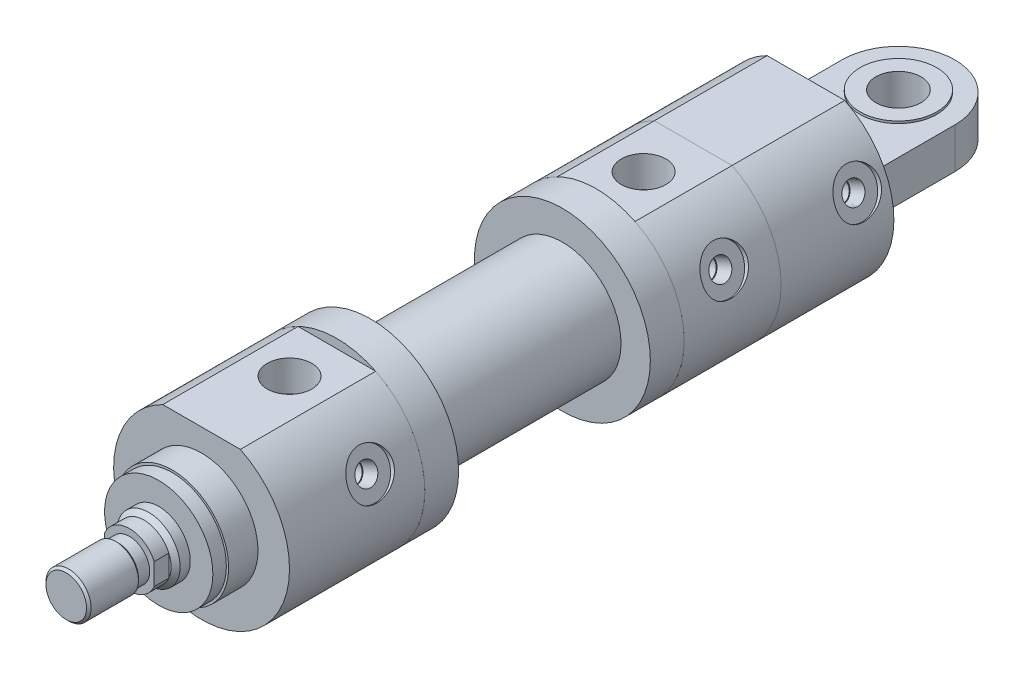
SolidWorks part; units mm, degrees
ref_plane "Plan de face" through (0, 0, 0) normal (0, 0, 1) x (1, 0, 0)
ref_plane "Plan de dessus" through (0, 0, 0) normal (0, 1, 0) x (1, 0, 0)
ref_plane "Plan de droite" through (0, 0, 0) normal (1, 0, 0) x (0, 0, -1)
sketch "Esquisse1" plane through (0, 0, 0) normal (0, 0, 1) x (1, 0, 0)
  circle A0 centre (0, 0) radius 39
  dimension "D1" = 78
extrude "Extrusion1" add sketch "Esquisse1" along normal blind 43
sketch "Esquisse2" plane through (0, 0, 43) normal (0, 0, 1) x (1, 0, 0)
  circle A0 centre (0, 0) radius 39
extrude "Extrusion2" add sketch "Esquisse2" along normal blind 15 separate body
sketch "Esquisse3" plane through (0, 0, 0) normal (0, 1, 0) x (1, 0, 0)
  line L1 (-39, -43) -> (39, -43)
  line L2 (-39, -43) -> (-39, 0)
  line L3 (-39, 0) -> (39, 0)
  line L4 (39, -43) -> (39, 0)
extrude "Enlèv. mat.-Extru.1" cut sketch "Esquisse3" along normal through all from offset 35
hole_wizard "Trou taraudé 1/2 NPT1" positions "1" profile "2" size "1/2" standard "Ansi Pouces"
sketch "1" plane through (0, 35, 0) normal (0, 1, 0) x (-1, 0, 0)
  line L1 (17.2047, 0) -> (-17.2047, 0) construction
  point P0 (0, 22)
  point P4 (0, 0)
  dimension "D1" = 22
sketch "2" plane through (0, 35, 22) normal (1, 0, 0) x (0, 0, 1)
  line L0 (0, 0) -> (0, 28.0035)
  line L1 (8.9281, 22.639) -> (0, 28.0035)
  line L2 (-8.9281, 22.639) -> (0, 28.0035) construction
  line L3 (8.9281, 22.639) -> (8.9281, 13.5712)
  line L4 (8.9281, 13.5712) -> (9.4797, 13.5712)
  line L5 (9.4797, 13.5712) -> (9.8861, 0)
  line L6 (-9.4797, 13.5712) -> (-9.8861, 0) construction
  line L7 (9.8861, 0) -> (0, 0)
  line L8 (0, -6.35) -> (0, 107.95) construction
  line L11 (-8.9281, 13.5712) -> (-9.4797, 13.5712) construction
  dimension "Diamètre du trou pour taraudage" = 17.8562
  dimension "Profondeur du trou pour taraudage" = 22.639
  dimension "Diamètre du filetage" = 19.7721
  dimension "Angle de filetage" = 3.43
  dimension "Profondeur du filetage" = 13.5712
  dimension "Angle de pointe" = 118
sketch "Esquisse6" plane through (0, 0, 58) normal (0, 0, 1) x (1, 0, 0)
  circle A0 centre (0, 0) radius 26
  dimension "D1" = 52
extrude "Extrusion3" add sketch "Esquisse6" along normal blind 85
sketch "Esquisse7" plane through (0, 0, 143) normal (0, 0, 1) x (1, 0, 0)
  circle A0 centre (0, 0) radius 39
  dimension "D1" = 78
extrude "Extrusion4" add sketch "Esquisse7" along normal blind 15
sketch "Esquisse8" plane through (0, 0, 158) normal (0, 0, 1) x (1, 0, 0)
  circle A2 centre (0, 0) radius 39
extrude "Extrusion5" add sketch "Esquisse8" along normal blind 60 separate body
sketch "Esquisse9" plane through (0, 0, 0) normal (0, 1, 0) x (1, 0, 0)
  line L0 (39, -218) -> (39, -158) construction
  line L1 (-39, -218) -> (39, -218)
  line L2 (-39, -218) -> (-39, -96)
  line L3 (-39, -96) -> (39, -96)
  line L4 (39, -218) -> (39, -96)
extrude "Enlèv. mat.-Extru.2" cut sketch "Esquisse9" along normal blind 57 from offset 35
hole_wizard "Trou taraudé 1/2 NPT2" positions "1" profile "2" size "1/2" standard "Ansi Pouces"
sketch "1" plane through (-3.0919, 35, 118.219) normal (0, 1, 0) x (-1, 0, 0)
  line L0 (14.1128, 99.781) -> (-20.2965, 99.781) construction
  point P0 (-3.0919, 60.781)
  dimension "D1" = 39
sketch "2" plane through (0, 35, 179) normal (1, 0, 0) x (0, 0, 1)
  line L0 (0, 0) -> (0, 28.0035)
  line L1 (8.9281, 22.639) -> (0, 28.0035)
  line L2 (-8.9281, 22.639) -> (0, 28.0035) construction
  line L3 (8.9281, 22.639) -> (8.9281, 13.5712)
  line L4 (8.9281, 13.5712) -> (9.4797, 13.5712)
  line L5 (9.4797, 13.5712) -> (9.8861, 0)
  line L6 (-9.4797, 13.5712) -> (-9.8861, 0) construction
  line L7 (9.8861, 0) -> (0, 0)
  line L8 (0, -6.35) -> (0, 107.95) construction
  line L11 (-8.9281, 13.5712) -> (-9.4797, 13.5712) construction
  dimension "Diamètre du trou pour taraudage" = 17.8562
  dimension "Profondeur du trou pour taraudage" = 22.639
  dimension "Diamètre du filetage" = 19.7721
  dimension "Angle de filetage" = 3.43
  dimension "Profondeur du filetage" = 13.5712
  dimension "Angle de pointe" = 118
sketch "Esquisse10" plane through (0, 0, 218) normal (0, 0, 1) x (1, 0, 0)
  circle A0 centre (0, 0) radius 25
  dimension "D1" = 50
extrude "Extrusion6" add sketch "Esquisse10" along normal blind 13
sketch "Esquisse11" plane through (0, 0, 231) normal (0, 0, 1) x (1, 0, 0)
  circle A2 centre (0, 0) radius 24
  circle A3 centre (0, 0) radius 24
  dimension "D1" = 1
extrude "Extrusion7" add sketch "Esquisse11" along normal blind 6
sketch "Esquisse12" plane through (0, 0, 237) normal (0, 0, 1) x (1, 0, 0)
  circle A0 centre (0, 0) radius 14
  dimension "D1" = 28
extrude "Extrusion8" add sketch "Esquisse12" along normal blind 6.5
chamfer "Chanfrein1" distance 2 angle 45 1 edges at (14, 0, 243.5)
sketch "Esquisse13" plane through (0, 0, 243.5) normal (0, 0, 1) x (1, 0, 0)
  circle A2 centre (0, 0) radius 12
  circle A3 centre (0, 0) radius 12
  dimension "D1" = 0
extrude "Extrusion9" add sketch "Esquisse13" along normal blind 6.5
sketch "Esquisse15" plane through (0, 0, 0) normal (1, 0, 0) x (0, 0, -1)
  line L0 (-208.2459, 0) -> (-121.0201, 0) construction
  line L1 (-250, 9) -> (-255, 9)
  line L2 (-250, 12) -> (-250, -12) construction
  line L3 (-255, 9) -> (-256, 10)
  line L4 (-256, 10) -> (-277, 10)
  line L5 (-277, 10) -> (-278, 9)
  line L6 (-278, 9) -> (-278, 0)
  line L7 (-278, 0) -> (-250, 0)
  line L8 (-250, 0) -> (-250, 9)
  dimension "D1" = 20
  dimension "D2" = 5
  dimension "D3" = 28
  dimension "D4" = 45
  dimension "D5" = 45
  dimension "D6" = 1
revolve "Révolution1" add sketch "Esquisse15" angle 360 about L0
sketch "Esquisse16" plane through (0, 0, 250) normal (0, 0, 1) x (1, 0, 0)
  line L0 (0, 0) -> (0, 19.2529) construction
  line L1 (18.6103, -23.1149) -> (11, -23.1149)
  line L2 (18.6103, -23.1149) -> (18.6103, 21.2975)
  line L3 (18.6103, 21.2975) -> (11, 21.2975)
  line L4 (11, -23.1149) -> (11, 21.2975)
  line L5 (-11, -23.1149) -> (-11, 21.2975)
  line L6 (-18.6103, 21.2975) -> (-11, 21.2975)
  line L7 (-18.6103, -23.1149) -> (-18.6103, 21.2975)
  line L8 (-18.6103, -23.1149) -> (-11, -23.1149)
  dimension "D1" = 22
extrude "Enlèv. mat.-Extru.4" cut sketch "Esquisse16" against normal blind 6.5
sketch "Esquisse17" plane through (0, 0, 0) normal (0, 0, -1) x (-1, 0, 0)
  circle A0 centre (0, 0) radius 39
extrude "Extrusion10" add sketch "Esquisse17" along normal blind 50 separate body
sketch "Esquisse18" plane through (0, 0, 0) normal (0, 1, 0) x (1, 0, 0)
  line L1 (-39, 0) -> (39, 0)
  line L2 (-39, 0) -> (-39, 50)
  line L3 (-39, 50) -> (39, 50)
  line L4 (39, 0) -> (39, 50)
extrude "Enlèv. mat.-Extru.5" cut sketch "Esquisse18" along normal through all from offset 35
sketch "Esquisse19" plane through (0, 0, 0) normal (0, 1, 0) x (0, 0, -1)
  line L0 (50, 25) -> (91, 25)
  line L1 (50, -39) -> (50, 39) construction
  line L2 (91, -25) -> (50, -25)
  line L3 (50, -25) -> (50, 25)
  circle A0 centre (91, 0) radius 10
  arc A1 (91, 25) -> (91, -25) centre (91, 0) cw
  dimension "D1" = 20
  dimension "D2" = 25
  dimension "D3" = 41
extrude "Extrusion11" add sketch "Esquisse19" along normal mid plane 18
sketch "Esquisse20" plane through (0, 0, 0) normal (0, 1, 0) x (0, 0, -1)
  circle A1 centre (91, 0) radius 10 construction
  circle A2 centre (91, 0) radius 17
  circle A3 centre (91, 0) radius 17
  circle A4 centre (91, 0) radius 10
  dimension "D1" = 7
extrude "Extrusion12" add sketch "Esquisse20" along normal mid plane 20
ref_plane "Plan1" through (0, 0, 0) normal (0.9205, 0.3907, 0) x (0, 0, -1)
sketch "Esquisse21" plane through (0, 0, 0) normal (0.9205, 0.3907, 0) x (0, 0, -1)
  line L0 (-218, 0) -> (-158, 0) construction
  line L3 (-218, 38.9401) -> (-218, -39) construction
  circle A0 centre (-179, 0) radius 10
  dimension "D1" = 20
  dimension "D2" = 39
extrude "Enlèv. mat.-Extru.6" cut sketch "Esquisse21" against normal blind 2 from offset 39
sketch "Esquisse22" plane through (0, 0, 0) normal (0.9205, 0.3907, 0) x (0, 0, -1)
  line L0 (-43, 0) -> (0, 0) construction
  line L1 (-143, 0) -> (-58, 0) construction
  line L3 (-58, 39) -> (-58, -39) construction
  circle A0 centre (-22, 0) radius 10
  dimension "D1" = 20
  dimension "D2" = 36
extrude "Enlèv. mat.-Extru.7" cut sketch "Esquisse22" against normal blind 2 from offset 39
sketch "Esquisse23" plane through (0, 0, 0) normal (0.9205, 0.3907, 0) x (0, 0, -1)
  line L0 (50, 0) -> (0, 0) construction
  circle A0 centre (37, 0) radius 10
  circle A1 centre (-22, 0) radius 10 construction
  dimension "D1" = 20
  dimension "D2" = 59
extrude "Enlèv. mat.-Extru.8" cut sketch "Esquisse23" against normal blind 2 from offset 39
hole_wizard "Trou taraudé 1/8 NPT1" positions "5" profile "6" size "1/8" standard "Ansi Pouces"
sketch "5" plane through (34.0587, 14.4571, 0) normal (0.9205, 0.3907, 0) x (0, 0, -1)
  circle A0 centre (-179, 0) radius 10 construction
  point P0 (-179, 0)
sketch "6" plane through (34.0587, 14.4571, 179) normal (0, 0, 1) x (-0.3907, 0.9205, 0)
  line L0 (0, 0) -> (0, 14.1565)
  line L1 (4.2164, 11.623) -> (0, 14.1565)
  line L2 (-4.2164, 11.623) -> (0, 14.1565) construction
  line L3 (4.2164, 11.623) -> (4.2164, 6.924)
  line L4 (4.2164, 6.924) -> (4.5374, 6.924)
  line L5 (4.5374, 6.924) -> (4.7447, 0)
  line L6 (-4.5374, 6.924) -> (-4.7447, 0) construction
  line L7 (4.7447, 0) -> (0, 0)
  line L8 (0, -6.35) -> (0, 107.95) construction
  line L11 (-4.2164, 6.924) -> (-4.5374, 6.924) construction
  dimension "Diamètre du trou pour taraudage" = 8.4328
  dimension "Profondeur du trou pour taraudage" = 11.623
  dimension "Diamètre du filetage" = 9.4894
  dimension "Angle de filetage" = 3.43
  dimension "Profondeur du filetage" = 6.924
  dimension "Angle de pointe" = 118
hole_wizard "Trou taraudé 1/8 NPT2" positions "3" profile "4" size "1/8" standard "Ansi Pouces"
sketch "3" plane through (34.8367, 12.6241, -96.1961) normal (0.9205, 0.3907, 0) x (0, 0, -1)
  circle A1 centre (-118.1961, 1.9913) radius 10 construction
  point P0 (-118.1961, 1.9913)
sketch "4" plane through (34.0587, 14.4571, 22) normal (0, 0, 1) x (-0.3907, 0.9205, 0)
  line L0 (0, 0) -> (0, 14.1565)
  line L1 (4.2164, 11.623) -> (0, 14.1565)
  line L2 (-4.2164, 11.623) -> (0, 14.1565) construction
  line L3 (4.2164, 11.623) -> (4.2164, 6.924)
  line L4 (4.2164, 6.924) -> (4.5374, 6.924)
  line L5 (4.5374, 6.924) -> (4.7447, 0)
  line L6 (-4.5374, 6.924) -> (-4.7447, 0) construction
  line L7 (4.7447, 0) -> (0, 0)
  line L8 (0, -6.35) -> (0, 107.95) construction
  line L11 (-4.2164, 6.924) -> (-4.5374, 6.924) construction
  dimension "Diamètre du trou pour taraudage" = 8.4328
  dimension "Profondeur du trou pour taraudage" = 11.623
  dimension "Diamètre du filetage" = 9.4894
  dimension "Angle de filetage" = 3.43
  dimension "Profondeur du filetage" = 6.924
  dimension "Angle de pointe" = 118
hole_wizard "Trou taraudé 1/8 NPT3" positions "5" profile "6" size "1/8" standard "Ansi Pouces"
sketch "5" plane through (34.7384, 12.8557, -159.3273) normal (0.9205, 0.3907, 0) x (0, 0, -1)
  circle A1 centre (-122.3273, 1.7396) radius 10 construction
  point P0 (-122.3273, 1.7396)
sketch "6" plane through (34.0587, 14.4571, -37) normal (0, 0, 1) x (-0.3907, 0.9205, 0)
  line L0 (0, 0) -> (0, 14.1565)
  line L1 (4.2164, 11.623) -> (0, 14.1565)
  line L2 (-4.2164, 11.623) -> (0, 14.1565) construction
  line L3 (4.2164, 11.623) -> (4.2164, 6.924)
  line L4 (4.2164, 6.924) -> (4.5374, 6.924)
  line L5 (4.5374, 6.924) -> (4.7447, 0)
  line L6 (-4.5374, 6.924) -> (-4.7447, 0) construction
  line L7 (4.7447, 0) -> (0, 0)
  line L8 (0, -6.35) -> (0, 107.95) construction
  line L11 (-4.2164, 6.924) -> (-4.5374, 6.924) construction
  dimension "Diamètre du trou pour taraudage" = 8.4328
  dimension "Profondeur du trou pour taraudage" = 11.623
  dimension "Diamètre du filetage" = 9.4894
  dimension "Angle de filetage" = 3.43
  dimension "Profondeur du filetage" = 6.924
  dimension "Angle de pointe" = 118
